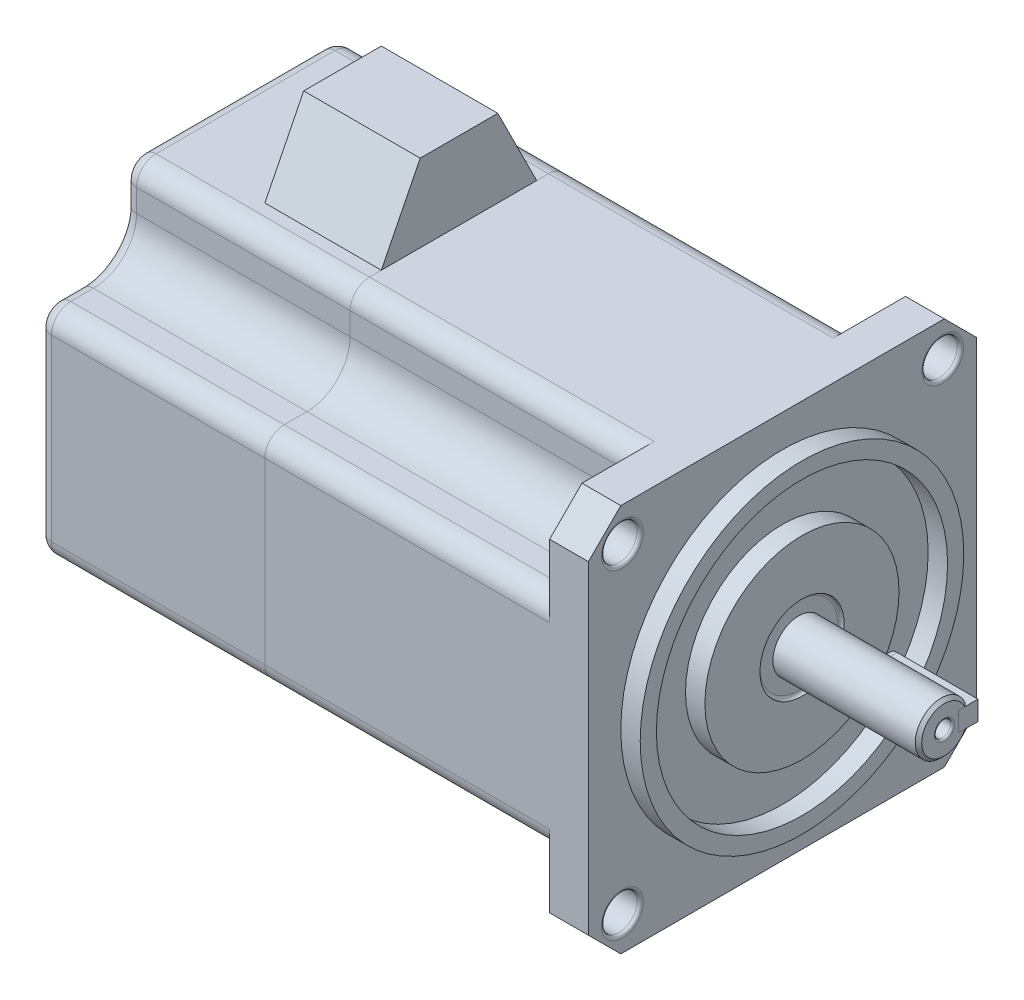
SolidWorks part; units mm, degrees
ref_plane "前视基准面" through (0, 0, 0) normal (0, 0, 1) x (1, 0, 0)
ref_plane "上视基准面" through (0, 0, 0) normal (0, 1, 0) x (1, 0, 0)
ref_plane "右视基准面" through (0, 0, 0) normal (1, 0, 0) x (0, 0, -1)
sketch "草图1" plane through (0, 0, 0) normal (1, 0, 0) x (0, 0, -1)
  line L0 (-30, 25) -> (-25, 30)
  line L1 (-25, -30) -> (25, -30)
  line L2 (-30, -25) -> (-30, 25)
  line L3 (-25, 30) -> (25, 30)
  line L4 (30, -25) -> (30, 25)
  line L5 (-30, -30) -> (30, 30) construction
  line L6 (-30, 30) -> (30, -30) construction
  line L7 (25, 30) -> (30, 25)
  line L8 (25, -30) -> (30, -25)
  line L9 (-30, -25) -> (-25, -30)
  point P0 (0, 0)
extrude "凸台-拉伸2" add sketch "草图1" against normal blind 50
sketch "草图2" plane through (-50, 0, 0) normal (-1, 0, 0) x (0, 0, 1)
  line L0 (-23.5, 16.8292) -> (-27, 16.8292)
  line L1 (-30, -25) -> (-30, 25) construction
  line L2 (-30, 13.8292) -> (-30, -13.8292)
  line L3 (-23.5, -16.8292) -> (-27, -16.8292)
  line L4 (-25, 30) -> (-30, 25)
  line L5 (-16.8292, -23.5) -> (-16.8292, -27)
  line L6 (25, -30) -> (-25, -30) construction
  line L7 (-13.8292, -30) -> (13.8292, -30)
  line L8 (30, -13.8292) -> (30, 13.8292)
  line L9 (16.8292, -23.5) -> (16.8292, -27)
  line L11 (-30, -25) -> (-30, -13.8292)
  line L12 (23.5, -16.8292) -> (27, -16.8292)
  line L13 (30, 25) -> (30, -25) construction
  line L14 (-30, -25) -> (-25, -30)
  line L15 (23.5, 16.8292) -> (27, 16.8292)
  line L16 (-25, -30) -> (-13.8292, -30)
  line L17 (16.8292, 23.5) -> (16.8292, 27)
  line L18 (-25, 30) -> (25, 30) construction
  line L19 (-13.8292, -30) -> (-13.8107, -29.8429)
  line L20 (13.8292, -30) -> (25, -30)
  line L21 (-16.8292, 23.5) -> (-16.8292, 27)
  line L22 (25, -30) -> (30, -25)
  line L23 (30, -25) -> (30, -13.8292)
  line L24 (30, 13.8292) -> (30, 25)
  line L25 (30, 25) -> (25, 30)
  line L26 (25, 30) -> (13.8292, 30)
  line L27 (-13.8292, 30) -> (-25, 30)
  line L28 (-30, 25) -> (-30, 13.8292)
  arc A0 (-23.5, 16.8292) -> (-16.8292, 23.5) centre (-23.5, 23.5) ccw
  arc A1 (16.8292, 23.5) -> (23.5, 16.8292) centre (23.5, 23.5) ccw
  arc A2 (23.5, -16.8292) -> (16.8292, -23.5) centre (23.5, -23.5) ccw
  arc A3 (-16.8292, -23.5) -> (-23.5, -16.8292) centre (-23.5, -23.5) ccw
  arc A4 (-27, 16.8292) -> (-30, 13.8292) centre (-27, 13.8292) ccw
  arc A5 (-27, -16.8292) -> (-30, -13.8292) centre (-27, -13.8292) cw
  arc A6 (-16.8292, -27) -> (-13.8292, -30) centre (-13.8292, -27) ccw
  arc A7 (16.8292, -27) -> (13.8292, -30) centre (13.8292, -27) cw
  arc A8 (27, -16.8292) -> (30, -13.8292) centre (27, -13.8292) ccw
  arc A9 (27, 16.8292) -> (30, 13.8292) centre (27, 13.8292) cw
  arc A10 (16.8292, 27) -> (13.8292, 30) centre (13.8292, 27) ccw
  arc A11 (-16.8292, 27) -> (-13.8292, 30) centre (-13.8292, 27) cw
  point P36 (-30, 16.8292)
  point P39 (-30, -16.8292)
  point P42 (-16.8292, -30)
  point P52 (16.8292, -30)
  point P55 (30, -16.8292)
  point P58 (30, 16.8292)
  point P61 (16.8292, 30)
  point P64 (-16.8292, 30)
  dimension "D1" = 3
extrude "切除-拉伸2" cut sketch "草图2" against normal blind 44 contours L21 A11 A4 L0 A0 M3 M4 M5 | A10 L17 A1 L15 A9 M1 M2 M3 | A8 L12 A2 L9 A7 M7 M8 M1 | A6 L5 A3 L3 A5 M5 M6 M7
sketch "草图4" plane through (0, 0, 0) normal (1, 0, 0) x (0, 0, -1)
  circle A1 centre (-24.7487, 24.7487) radius 2.75
  circle A2 centre (24.7487, 24.7487) radius 2.75
  circle A3 centre (24.7487, -24.7487) radius 2.75
  circle A4 centre (-24.7487, -24.7487) radius 2.75
extrude "切除-拉伸3" cut sketch "草图4" against normal blind 6
sketch "草图5" plane through (0, 0, 0) normal (1, 0, 0) x (0, 0, -1)
  circle A0 centre (0, 0) radius 25
  circle A1 centre (0, 0) radius 22.5
extrude "凸台-拉伸3" add sketch "草图5" along normal blind 3
sketch "草图6" plane through (0, 0, 0) normal (1, 0, 0) x (0, 0, -1)
  circle A0 centre (0, 0) radius 15
extrude "凸台-拉伸4" add sketch "草图6" along normal blind 3
sketch "草图7" plane through (3, 0, 0) normal (1, 0, 0) x (0, 0, -1)
  circle A0 centre (0, 0) radius 6.5
extrude "切除-拉伸4" cut sketch "草图7" against normal blind 0.5
fillet "圆角1" radius 0.5 1 edges at (2.5, 0, -6.5)
sketch "草图8" plane through (2.5, 0, 0) normal (1, 0, 0) x (0, 0, -1)
  circle A0 centre (0, 0) radius 4
ref_plane "基准面1" through (0, 0, -4) normal (0, 0, 1) x (1, 0, 0)
sketch "草图12" plane through (-50, 0, 0) normal (-1, 0, 0) x (0, 0, 1)
  line L0 (-23.5, 16.8292) -> (-27, 16.8292)
  line L1 (-30, 25) -> (-30, 13.8292) construction
  line L2 (-30, -13.8292) -> (-30, 13.8292)
  line L3 (-23.5, -16.8292) -> (-27, -16.8292)
  line L4 (-30, -13.8292) -> (-30, -25) construction
  line L5 (-13.8292, 30) -> (13.8292, 30)
  line L6 (-16.8292, -23.5) -> (-16.8292, -27)
  line L7 (-25, -30) -> (-13.8292, -30) construction
  line L8 (30, 13.8292) -> (30, -13.8292)
  line L9 (16.8292, -23.5) -> (16.8292, -27)
  line L10 (13.8292, -30) -> (25, -30) construction
  line L11 (13.8292, -30) -> (-13.8292, -30)
  line L12 (23.5, -16.8292) -> (27, -16.8292)
  line L13 (30, -25) -> (30, -13.8292) construction
  line L15 (23.5, 16.8292) -> (27, 16.8292)
  line L16 (30, 13.8292) -> (30, 25) construction
  line L18 (16.8292, 23.5) -> (16.8292, 27)
  line L19 (25, 30) -> (13.8292, 30) construction
  line L21 (-16.8292, 23.5) -> (-16.8292, 27)
  line L22 (-13.8292, 30) -> (-25, 30) construction
  arc A0 (-16.8292, -23.5) -> (-23.5, -16.8292) centre (-23.5, -23.5) ccw
  arc A1 (23.5, -16.8292) -> (16.8292, -23.5) centre (23.5, -23.5) ccw
  arc A2 (16.8292, 23.5) -> (23.5, 16.8292) centre (23.5, 23.5) ccw
  arc A3 (-23.5, 16.8292) -> (-16.8292, 23.5) centre (-23.5, 23.5) ccw
  arc A4 (-27, -16.8292) -> (-30, -13.8292) centre (-27, -13.8292) cw
  arc A5 (-16.8292, -27) -> (-13.8292, -30) centre (-13.8292, -27) ccw
  arc A6 (16.8292, -27) -> (13.8292, -30) centre (13.8292, -27) cw
  arc A7 (27, -16.8292) -> (30, -13.8292) centre (27, -13.8292) ccw
  arc A8 (27, 16.8292) -> (30, 13.8292) centre (27, 13.8292) cw
  arc A9 (16.8292, 27) -> (13.8292, 30) centre (13.8292, 27) ccw
  arc A10 (-16.8292, 27) -> (-13.8292, 30) centre (-13.8292, 27) cw
  arc A11 (-27, 16.8292) -> (-30, 13.8292) centre (-27, 13.8292) ccw
  point P5 (-30, -16.8292)
  point P20 (-16.8292, -30)
  point P53 (16.8292, -30)
  point P56 (30, -16.8292)
  point P59 (30, 16.8292)
  point P62 (16.8292, 30)
  point P65 (-16.8292, 30)
  point P68 (-30, 16.8292)
  dimension "D1" = 3
extrude "凸台-拉伸8" add sketch "草图12" along normal blind 35 separate body
fillet "圆角2" radius 2 24 edges at (-85, 18.783, -18.783) (-85, 15.9505, -29.1213) (-85, 29.1213, -15.9505) (-85, -15.9505, -29.1213) (-85, -18.783, -18.783) (-85, 29.1213, 15.9505) (-85, -29.1213, -15.9505) (-85, 18.783, 18.783) (-85, 15.9505, 29.1213) (-85, -29.1213, 15.9505) (-85, -18.783, 18.783) (-85, -15.9505, 29.1213) (-85, 0, -30) (-85, 30, 0) (-85, 0, 30) (-85, -30, 0) (-85, 16.8292, -25.25) (-85, 25.25, -16.8292) (-85, 25.25, 16.8292) (-85, 16.8292, 25.25) (-85, -16.8292, 25.25) (-85, -25.25, 16.8292) (-85, -25.25, -16.8292) (-85, -16.8292, -25.25)
extrude "凸台-拉伸9" add sketch "草图8" along normal blind 22.5 contours A0
sketch "草图21" plane through (0, 0, -4) normal (0, 0, 1) x (1, 0, 0)
  line L1 (25, -4) -> (25, 4) construction
  line L2 (12.5, 1.5) -> (25, 1.5)
  line L3 (25, 1.5) -> (25, -1.5)
  line L4 (25, -1.5) -> (12.5, -1.5)
  arc A0 (12.5, 1.5) -> (12.5, -1.5) centre (12.5, 0) ccw
extrude "切除-拉伸9" cut sketch "草图21" along normal blind 1.8
sketch "草图22" plane through (0, 0, -2.2) normal (0, 0, -1) x (-1, 0, 0)
  line L0 (-12.5, 1.5) -> (-25, 1.5)
  line L1 (-25, 1.5) -> (-25, -1.5)
  line L2 (-25, -1.5) -> (-12.5, -1.5)
  arc A0 (-12.5, -1.5) -> (-12.5, 1.5) centre (-12.5, 0) ccw
extrude "凸台-拉伸10" add sketch "草图22" along normal blind 3 separate body
chamfer "倒角1" distance 0.5 angle 45 1 edges at (25, 0, 4)
sketch "草图24" plane through (0, 30, 0) normal (0, 1, 0) x (1, 0, 0)
  line L3 (-68, -12) -> (-50, -12)
  line L4 (-68, -12) -> (-68, 12)
  line L5 (-68, 12) -> (-50, 12)
  line L6 (-50, -12) -> (-50, 12)
  line L7 (-68, -12) -> (-50, 12) construction
  line L8 (-68, 12) -> (-50, -12) construction
extrude "凸台-拉伸11" add sketch "草图24" along normal blind 12 separate body
sketch "草图25" plane through (-50, 0, 0) normal (1, 0, 0) x (0, 0, -1)
  line L0 (-12, 30) -> (-12, 42)
  line L1 (-12, 42) -> (-6, 42)
  line L2 (-12, 42) -> (12, 42) construction
  line L3 (-6, 42) -> (-12, 30)
  line L4 (12, 30) -> (12, 42)
  line L5 (12, 42) -> (6, 42)
  line L6 (6, 42) -> (12, 30)
extrude "切除-拉伸10" cut sketch "草图25" against normal blind 18
hole_wizard "M3 螺纹孔1" positions "草图27" profile "草图26" tap size "M3" standard "GB"
sketch "草图27" plane through (25, 0, 0) normal (1, 0, 0) x (0, 0, -1)
  point P0 (0, 0)
sketch "草图26" plane through (25, 0, 0) normal (0, 1, 0) x (0, 0, -1)
  line L0 (0, 0) -> (0, 9.2511)
  line L1 (0, 9.2511) -> (1.25, 8.5)
  line L2 (1.25, 8.5) -> (1.25, 0)
  line L5 (1.25, 0) -> (0, 0)
  line L10 (0, 9.2511) -> (-1.25, 8.5) construction
  line L11 (0, -6.35) -> (0, 107.95) construction
  dimension "螺纹孔钻头直径" = 2.5
  dimension "螺纹孔钻头深度" = 8.5
  dimension "导头角度" = 118
fillet "圆角3" radius 0.5 4 edges at (0, 24.7487, -27.4987) (0, -24.7487, -27.4987) (0, -24.7487, 21.9987) (0, 24.7487, 21.9987)
fillet "圆角4" radius 0.3 1 edges at (25, 0, -1.25)
